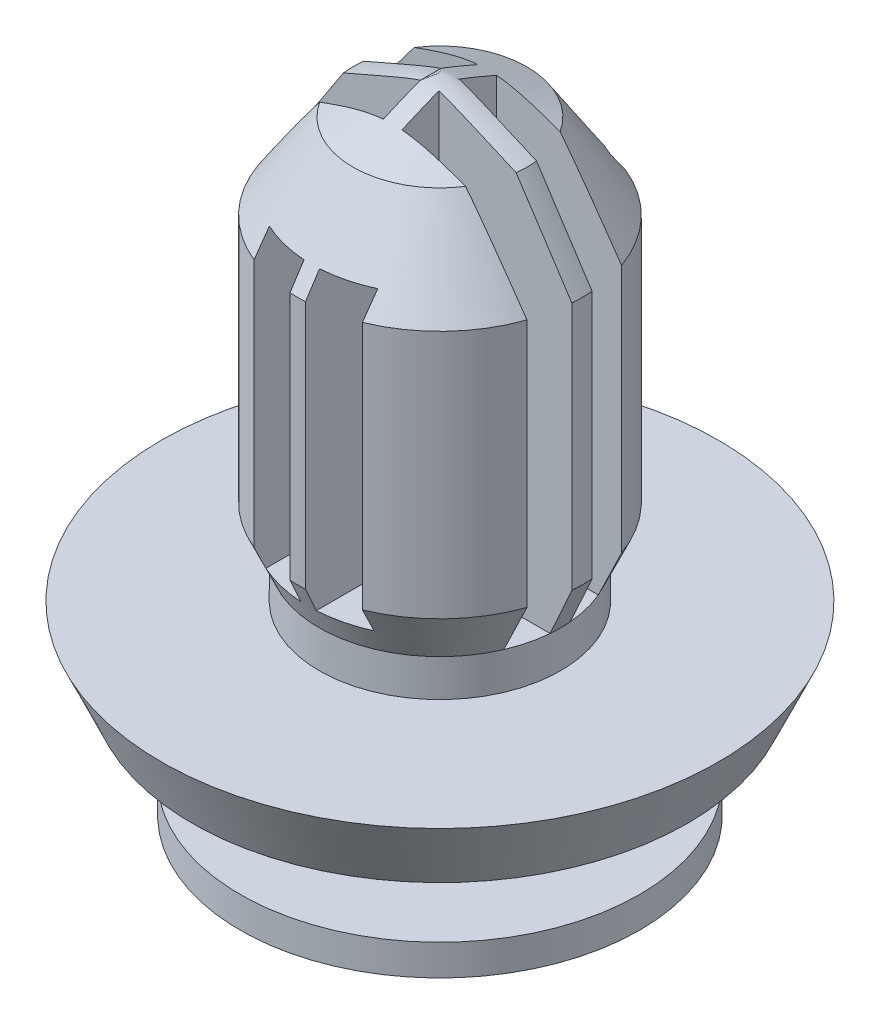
SolidWorks part; units mm, degrees
ref_plane "Front Plane" through (0, 0, 0) normal (0, 0, 1) x (1, 0, 0)
ref_plane "Top Plane" through (0, 0, 0) normal (0, 1, 0) x (1, 0, 0)
ref_plane "Right Plane" through (0, 0, 0) normal (1, 0, 0) x (0, 0, -1)
sketch "Sketch1" plane through (0, 0, 0) normal (0, 0, 1) x (1, 0, 0)
  line L0 (0, 0) -> (-6.45, 0)
  line L1 (-6.45, 0) -> (-6.45, 1)
  line L2 (-6.45, 1) -> (-2.8613, 1)
  line L3 (-2.8613, 1) -> (-2.8613, 3.765)
  line L4 (-2.8613, 3.765) -> (-8, 3.765)
  line L5 (-8, 3.765) -> (-9, 5.985)
  line L6 (-9, 5.985) -> (-3.9, 5.985)
  line L7 (-3.9, 5.985) -> (-3.9, 7.185)
  line L8 (-3.9, 7.185) -> (-4.6, 8.739)
  line L9 (-4.6, 8.739) -> (-4.6, 18.739)
  line L10 (-4.6, 18.739) -> (0, 20.765)
  line L11 (0, 20.765) -> (0, 0)
  point P3 (-3.1976, 6.7252)
  point P14 (-3.7448, 7.7854)
  dimension "D1" = 6.45
  dimension "D2" = 1
  dimension "D3" = 2.765
  dimension "D4" = 2.22
  dimension "D5" = 1.2
  dimension "D6" = 4.6
  dimension "D7" = 8
  dimension "D8" = 9
  dimension "D9" = 3.9
  dimension "D10" = 17
  dimension "D11" = 10
other "AlignGroup1"
revolve "Revolve1" add sketch "Sketch1" angle 360 about L11
fillet "Chamfer1" radius 3 1 edges at (-4.6, 18.739, 0)
ref_plane "Plane1" through (0.3, 0, 0) normal (1, 0, 0) x (0, 0, -1)
sketch "Sketch3" plane through (0.3, 0, 0) normal (1, 0, 0) x (0, 0, -1)
  line L0 (-0.0778, 21.6906) -> (-0.0778, 3.765) construction
  line L2 (-3.9, 7.185) -> (3.9, 7.185) construction
  line L3 (-0.3278, 21.2045) -> (-1.5278, 21.2045)
  line L4 (-0.3278, 21.2045) -> (-0.3278, 7.185)
  line L5 (-0.3278, 7.185) -> (-1.5278, 7.185)
  line L6 (-1.5278, 21.2045) -> (-1.5278, 7.185)
  dimension "D1" = 1.2
  dimension "D2" = 0.5
extrude "Cut-Extrude1" cut sketch "Sketch3" along normal blind 10
mirror "Mirror1" about plane through (0, 0, 0) normal (0, 0, 1) of "Cut-Extrude1"
mirror "Mirror2" about plane through (0, 0, 0) normal (1, 0, 0) of "Mirror1", "Cut-Extrude1"
ref_plane "Plane2" through (0, 0, 0.3) normal (0, 0, 1) x (1, 0, 0)
sketch "Sketch4" plane through (0, 0, 0.3) normal (0, 0, 1) x (1, 0, 0)
  line L0 (0, 21.8063) -> (0, -0.3006) construction
  line L2 (-1.75, 17.4775) -> (-0.25, 17.4775)
  line L3 (-1.75, 17.4775) -> (-1.75, 7.9635)
  line L4 (-1.75, 7.9635) -> (-0.25, 7.9635)
  line L5 (-0.25, 17.4775) -> (-0.25, 7.9635)
  point P7 (-1, 17.4775)
  dimension "D1" = 0.5
  dimension "D2" = 2
extrude "Cut-Extrude2" cut sketch "Sketch4" along normal through all contours L3 L4 L5 L2
mirror "Mirror3" about plane through (0, 0, 0) normal (1, 0, 0) of "Cut-Extrude2"
mirror "Mirror4" about plane through (0, 0, 0) normal (0, 0, 1) of "Cut-Extrude2", "Mirror3"
